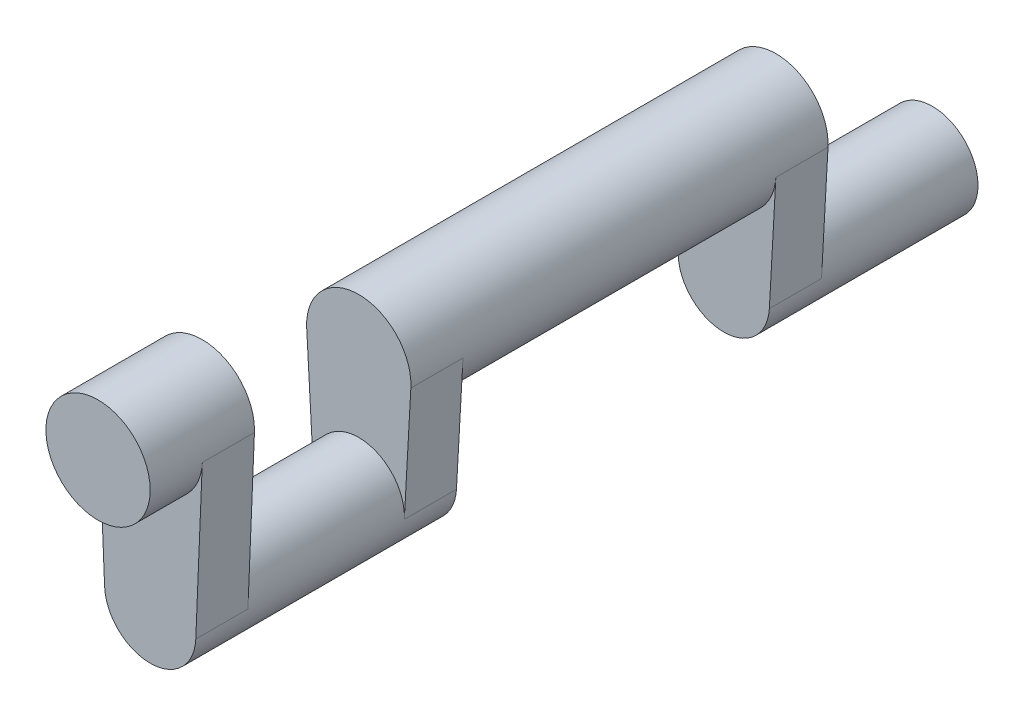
SolidWorks part; units mm, degrees
ref_plane "Front Plane" through (0, 0, 0) normal (0, 0, 1) x (1, 0, 0)
ref_plane "Top Plane" through (0, 0, 0) normal (0, 1, 0) x (1, 0, 0)
ref_plane "Right Plane" through (0, 0, 0) normal (1, 0, 0) x (0, 0, -1)
sketch "Sketch1" plane through (0, 0, 0) normal (0, 0, 1) x (1, 0, 0)
  circle A0 centre (0, 0) radius 25.4
  dimension "D1" = 50.8
extrude "Extrude1" add sketch "Sketch1" against normal blind 25.4
sketch "Sketch2" plane through (0, 0, -25.4) normal (0, 0, -1) x (-1, 0, 0)
  line L0 (-25.3779, -1.0583) -> (-22.2057, -77.126)
  line L1 (22.2057, -77.126) -> (25.3779, -1.0583)
  line L2 (0, 0) -> (0, -76.2) construction
  circle A0 centre (0, 0) radius 25.4 construction
  arc A1 (-22.2057, -77.126) -> (22.2057, -77.126) centre (0, -76.2) ccw
  arc A2 (25.3779, -1.0583) -> (-25.3779, -1.0583) centre (0, 0) ccw
  arc A5 (-17.9539, -89.2999) -> (17.9539, -63.1001) centre (0, -76.2) ccw construction
  dimension "D1" = 76.2
extrude "large offset" add sketch "Sketch2" along normal blind 25.4
sketch "Sketch3" plane through (0, 0, -50.8) normal (0, 0, -1) x (-1, 0, 0)
  circle A0 centre (0, -76.2) radius 22.225
  arc A1 (-22.2057, -77.126) -> (22.2057, -77.126) centre (0, -76.2) ccw construction
extrude "short cylinder1" add sketch "Sketch3" along normal blind 76.2
sketch "Sketch4" plane through (0, 0, -127) normal (0, 0, -1) x (-1, 0, 0)
  line L0 (-22.1907, -77.4347) -> (-25.3608, -20.4611)
  line L1 (25.3608, -20.4611) -> (22.1907, -77.4347)
  line L2 (0, -76.2) -> (0, -19.05) construction
  arc A0 (-25.3608, -20.4611) -> (25.3608, -20.4611) centre (0, -19.05) cw
  circle A1 centre (0, -76.2) radius 22.225
  arc A2 (-22.1907, -77.4347) -> (22.1907, -77.4347) centre (0, -76.2) ccw
  arc A5 (-66.6859, -124.8569) -> (66.6859, -27.5431) centre (0, -76.2) ccw
  circle A6 centre (0, -76.2) radius 82.55 construction
  dimension "D2" = 25.4
  dimension "D3" = 6.35
  dimension "D1" = 0
extrude "small offset1" add sketch "Sketch4" along normal blind 25.4
sketch "Sketch5" plane through (0, 0, -127) normal (0, 0, -1) x (-1, 0, 0)
  circle A0 centre (0, -19.05) radius 25.4
extrude "long cylinder" add sketch "Sketch5" along normal up to surface (203.2 mm away)
sketch "Sketch6" plane through (0, 0, -330.2) normal (0, 0, -1) x (-1, 0, 0)
  line L0 (25.3608, -20.4611) -> (22.1907, -77.4347)
  line L1 (-22.1907, -77.4347) -> (-25.3608, -20.4611)
  line L2 (0, -76.2) -> (0, -19.05) construction
  arc A0 (22.1907, -77.4347) -> (-22.1907, -77.4347) centre (0, -76.2) cw
  circle A1 centre (0, -19.05) radius 25.4
  arc A2 (25.3608, -20.4611) -> (-25.3608, -20.4611) centre (0, -19.05) ccw
  arc A5 (-17.9539, -89.2999) -> (17.9539, -63.1001) centre (0, -76.2) ccw construction
  arc A6 (-22.1907, -77.4347) -> (22.1907, -77.4347) centre (0, -76.2) ccw construction
  dimension "D1" = 0
extrude "small offset2" add sketch "Sketch6" against normal blind 25.4
sketch "Sketch7" plane through (0, 0, -330.2) normal (0, 0, 1) x (1, 0, 0)
  circle A0 centre (0, -76.2) radius 22.225
extrude "short cylinder2" add sketch "Sketch7" against normal blind 76.2
